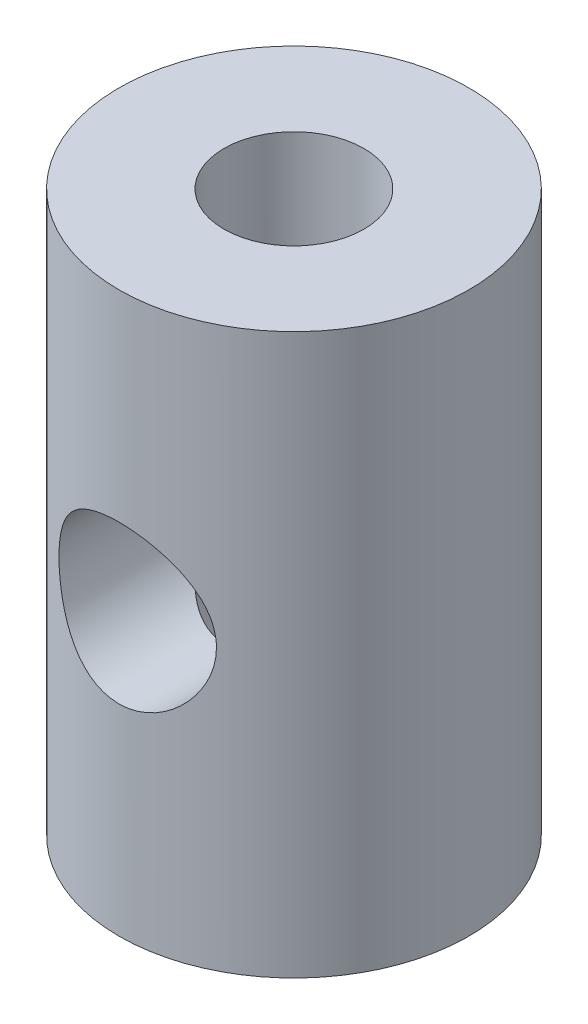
SolidWorks part; units mm, degrees
ref_plane "Front" through (0, 0, 0) normal (0, 0, 1) x (1, 0, 0)
ref_plane "Top" through (0, 0, 0) normal (0, 1, 0) x (1, 0, 0)
ref_plane "Right" through (0, 0, 0) normal (1, 0, 0) x (0, 0, -1)
sketch "Sketch1" plane through (0, 0, 0) normal (0, 1, 0) x (1, 0, 0)
  circle A0 centre (0, 0) radius 5
  circle A1 centre (0, 0) radius 2
extrude "Extrude2" add sketch "Sketch1" along normal blind 16
sketch "Sketch2" plane through (0, 0, 0) normal (0, 0, 1) x (1, 0, 0)
  circle A0 centre (0, 8) radius 2.25
extrude "Cut-Extrude1" cut sketch "Sketch2" against normal mid plane 16
